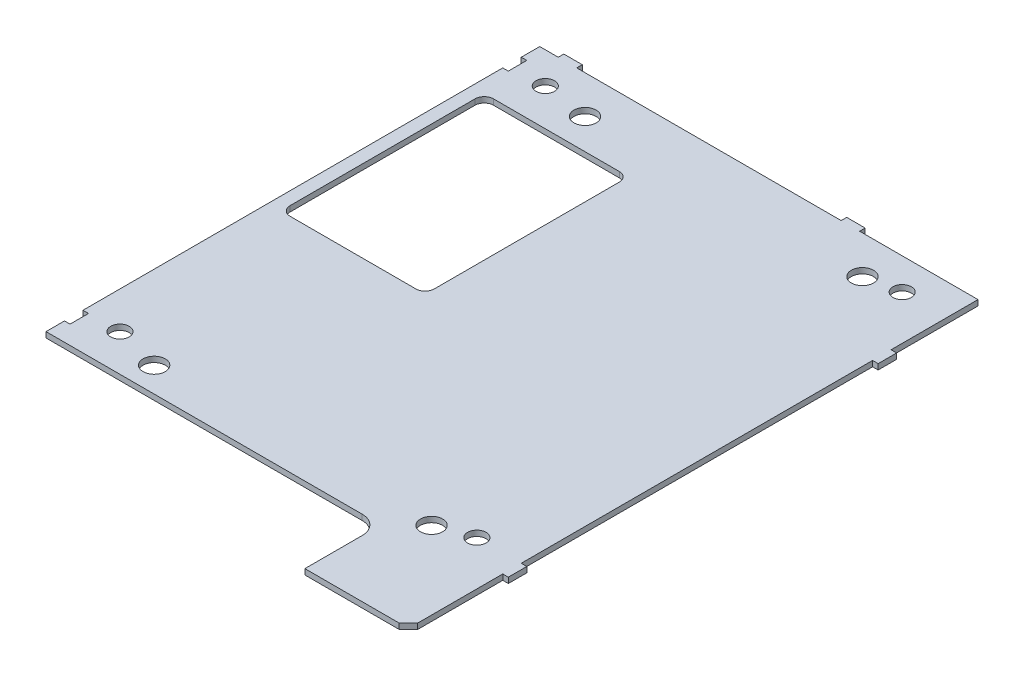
SolidWorks part; units mm, degrees
ref_plane "Спереди" through (0, 0, 0) normal (0, 0, 1) x (1, 0, 0)
ref_plane "Сверху" through (0, 0, 0) normal (0, 1, 0) x (1, 0, 0)
ref_plane "Справа" through (0, 0, 0) normal (1, 0, 0) x (0, 0, -1)
sketch "Эскиз1" plane through (0, 0, 0) normal (0, 1, 0) x (1, 0, 0)
  line L1 (0, 307) -> (530, 307)
  line L2 (0, 307) -> (0, 0)
  line L3 (0, 0) -> (530, 0)
  line L4 (530, 307) -> (530, 0)
  dimension "D2" = 307
  dimension "D4" = 530
extrude "Бобышка-Вытянуть1" add sketch "Эскиз1" along normal blind 3
sketch "Эскиз3" plane through (0, 3, 0) normal (0, 1, 0) x (1, 0, 0)
  line L0 (0, 307) -> (0, 0) construction
  line L1 (0, 270) -> (102, 270)
  line L2 (0, 270) -> (0, 70)
  line L3 (0, 70) -> (102, 70)
  line L4 (102, 270) -> (102, 70)
  line L6 (0, 0) -> (530, 0) construction
  dimension "D1" = 200
  dimension "D2" = 102
  dimension "D3" = 70
extrude "Вырез-Вытянуть2" cut sketch "Эскиз3" against normal through all
fillet "Скругление2" radius 5 2 edges at (102, 1.5, -70) (102, 1.5, -270)
sketch "Эскиз4" plane through (0, 3, 0) normal (0, 1, 0) x (1, 0, 0)
  line L0 (0, 0) -> (530, 0) construction
  line L1 (0, 307) -> (27.5, 307)
  line L2 (0, 307) -> (0, 0)
  line L3 (0, 0) -> (27.5, 0)
  line L4 (27.5, 307) -> (27.5, 0)
  dimension "D1" = 27.5
extrude "Вырез-Вытянуть3" cut sketch "Эскиз4" against normal through all
sketch "Эскиз7" plane through (0, 3, 0) normal (0, 1, 0) x (1, 0, 0)
  line L1 (530, 307) -> (700, 307)
  line L2 (530, 307) -> (530, 0)
  line L3 (530, 0) -> (700, 0)
  line L4 (700, 307) -> (700, 0)
  dimension "D1" = 170
extrude "Бобышка-Вытянуть2" add sketch "Эскиз7" against normal up to surface (3 mm away)
sketch "Эскиз8" plane through (0, 3, 0) normal (0, 1, 0) x (1, 0, 0)
  line L0 (700, 307) -> (27.5, 307) construction
  line L1 (530, 307) -> (700, 307)
  line L2 (530, 307) -> (530, 160)
  line L3 (530, 160) -> (700, 160)
  line L4 (700, 307) -> (700, 160)
  line L5 (700, 0) -> (700, 307) construction
  line L6 (27.5, 0) -> (700, 0) construction
  dimension "D1" = 170
  dimension "D2" = 160
extrude "Вырез-Вытянуть4" cut sketch "Эскиз8" against normal through all
sketch "Эскиз11" plane through (0, 0, 0) normal (0, -1, 0) x (1, 0, 0)
  line L0 (27.5, 0) -> (700, 0) construction
  line L1 (27.5, -70) -> (-20, -70)
  line L2 (27.5, -70) -> (27.5, 0)
  line L3 (530, -307) -> (27.5, -307) construction
  line L4 (-20, -70) -> (-20, 0)
  line L6 (27.5, -307) -> (-20, -307)
  line L7 (-20, -270) -> (-20, -307)
  line L8 (27.5, -270) -> (-20, -270)
  line L9 (27.5, -270) -> (27.5, -307)
  line L10 (27.5, 0) -> (-20, 0)
  line L11 (27.5, -270) -> (27.5, -307) construction
extrude "Бобышка-Вытянуть3" add sketch "Эскиз11" against normal up to surface (3 mm away)
hole_wizard "Диаметр отверстия Ø10.0 (10)1" positions "Эскиз12" profile "Эскиз14" hole size "Ø10.0" standard "ISO"
sketch "Эскиз12" plane through (0, 3, 0) normal (0, 1, 0) x (1, 0, 0)
  line L0 (700, 80) -> (135.4022, 80) construction
  line L1 (700, 0) -> (700, 160) construction
  point P0 (547.5, 152.5)
  point P2 (692.5, 152.5)
  point P4 (692.5, 7.5)
  point P6 (547.5, 7.5)
  dimension "D1" = 145
  dimension "D2" = 145
  dimension "D3" = 7.5
sketch "Эскиз14" plane through (547.5, 3, -152.5) normal (1, 0, 0) x (0, 0, 1)
  line L0 (0, 0) -> (0, 3)
  line L1 (0, 3) -> (5, 3)
  line L2 (5, 3) -> (5, 0)
  line L5 (5, 0) -> (0, 0)
  line L11 (0, -6.35) -> (0, 107.95) construction
  dimension "Диаметр сквозного отверстия" = 10
  dimension "Глубина сквозного отверстия" = 3
sketch "Эскиз16" plane through (0, 0, 0) normal (0, -1, 0) x (1, 0, 0)
  line L1 (-20, -70) -> (24, -70)
  line L2 (-20, -70) -> (-20, -270)
  line L3 (-20, -270) -> (24, -270)
  line L4 (24, -70) -> (24, -270)
  line L5 (97, -270) -> (-20, -270) construction
  dimension "D1" = 44
extrude "Бобышка-Вытянуть5" add sketch "Эскиз16" against normal up to surface (3 mm away)
fillet "Скругление4" radius 5 2 edges at (24, 1.5, -270) (24, 1.5, -70)
sketch "Эскиз18" plane through (0, 3, 0) normal (0, 1, 0) x (1, 0, 0)
  line L0 (700, 0) -> (700, 160) construction
  line L1 (700, 160) -> (707, 160)
  line L2 (700, 160) -> (700, 0)
  line L3 (700, 0) -> (707, 0)
  line L4 (707, 160) -> (707, 0)
  line L6 (-20, 0) -> (700, 0) construction
  dimension "D1" = 7
extrude "Бобышка-Вытянуть7" add sketch "Эскиз18" against normal up to surface (3 mm away)
sketch "Эскиз19" plane through (0, 3, 0) normal (0, 1, 0) x (1, 0, 0)
  line L1 (530, 160) -> (707, 160)
  line L2 (530, 160) -> (530, 0)
  line L3 (530, 0) -> (707, 0)
  line L4 (707, 160) -> (707, 0)
extrude "Вырез-Вытянуть5" cut sketch "Эскиз19" against normal through all
sketch "Эскиз21" plane through (0, 3, 0) normal (0, 1, 0) x (1, 0, 0)
  line L0 (-20, 0) -> (530, 0) construction
  line L1 (530, 307) -> (550, 307)
  line L2 (530, 307) -> (530, 0)
  line L3 (530, 0) -> (550, 0)
  line L4 (550, 307) -> (550, 0)
  dimension "D1" = 20
extrude "Бобышка-Вытянуть8" add sketch "Эскиз21" against normal up to surface (3 mm away)
sketch "Эскиз20" plane through (0, 3, 0) normal (0, 1, 0) x (1, 0, 0)
  line L0 (-20, 0) -> (550, 0) construction
  line L2 (550, 0) -> (550, 307) construction
  circle A0 centre (530.5, 65) radius 6
  circle A1 centre (400.5, 65) radius 6
  circle A2 centre (400.5, 255) radius 6
  circle A3 centre (530.5, 255) radius 6
  dimension "D1" = 12
  dimension "D2" = 65
  dimension "D4" = 190
  dimension "D5" = 19.5
  dimension "D3" = 130
extrude "Вырез-Вытянуть6" cut sketch "Эскиз20" against normal through all
sketch "Эскиз22" plane through (0, 3, 0) normal (0, 1, 0) x (1, 0, 0)
  line L0 (24, 265) -> (24, 75) construction
  line L1 (24, 160) -> (102, 160)
  line L2 (24, 160) -> (24, 70)
  line L3 (24, 70) -> (102, 70)
  line L4 (102, 160) -> (102, 70)
  line L5 (102, 75) -> (102, 265) construction
  line L6 (29, 70) -> (97, 70) construction
  line L7 (97, 270) -> (29, 270) construction
  dimension "D1" = 110
extrude "Бобышка-Вытянуть9" add sketch "Эскиз22" against normal up to surface (3 mm away)
fillet "Скругление5" radius 5 2 edges at (24, 1.5, -160) (102, 1.5, -160)
hole_wizard "Диаметр отверстия Ø12.0 (12)2" positions "Эскиз5" profile "Эскиз6" hole size "Ø12.0" standard "ISO"
sketch "Эскиз5" plane through (0, 0, 0) normal (0, -1, 0) x (-1, 0, 0)
  line L8 (20, 0) -> (20, 307) construction
  line L9 (20, 0) -> (-550, 0) construction
  point P0 (-62, 53.5)
  point P2 (-212, 53.5)
  point P4 (-212, 286.5)
  point P6 (-62, 286.5)
  dimension "D1" = 82
  dimension "D2" = 233
  dimension "D3" = 150
  dimension "D4" = 53.5
sketch "Эскиз6" plane through (62, 0, -53.5) normal (1, 0, 0) x (0, 0, -1)
  line L0 (0, 0) -> (0, 3)
  line L1 (0, 3) -> (6, 3)
  line L2 (6, 3) -> (6, 0)
  line L5 (6, 0) -> (0, 0)
  line L11 (0, -6.35) -> (0, 107.95) construction
  dimension "Диаметр сквозного отверстия" = 12
  dimension "Глубина сквозного отверстия" = 3
sketch "Эскиз23" plane through (0, 0, 0) normal (0, -1, 0) x (1, 0, 0)
  line L0 (-20, 0) -> (-20, -307) construction
  line L1 (-20, -50) -> (20, -50)
  line L2 (-20, -50) -> (-20, -60)
  line L3 (-20, -60) -> (20, -60)
  line L4 (20, -50) -> (20, -60)
  line L5 (20, -292) -> (12.7851, -292) construction
  line L6 (-20, -287) -> (20, -287)
  line L7 (-20, -287) -> (-20, -297)
  line L8 (-20, -297) -> (20, -297)
  line L9 (20, -287) -> (20, -297)
  line L10 (550, -307) -> (-20, -307) construction
  line L11 (20, -55) -> (8.4334, -55) construction
  line L12 (-20, 0) -> (550, 0) construction
  dimension "D1" = 10
  dimension "D2" = 40
  dimension "D3" = 15
  dimension "D4" = 55
  dimension "D5" = 237
extrude "Вырез-Вытянуть7" cut sketch "Эскиз23" against normal through all
sketch "Эскиз27" plane through (0, 0, 0) normal (0, -1, 0) x (1, 0, 0)
  line L0 (550, -307) -> (550, 0) construction
  line L1 (550, -284) -> (547, -284)
  line L2 (550, -284) -> (550, -294)
  line L3 (550, -294) -> (547, -294)
  line L4 (547, -284) -> (547, -294)
  line L5 (550, -289) -> (560.6555, -289) construction
  line L6 (550, -307) -> (-20, -307) construction
  line L7 (550, -10) -> (569.4363, -10) construction
  line L8 (550, -5) -> (547, -5)
  line L9 (550, -5) -> (550, -15)
  line L10 (550, -15) -> (547, -15)
  line L11 (547, -5) -> (547, -15)
  line L12 (-20, 0) -> (550, 0) construction
  dimension "D1" = 3
  dimension "D2" = 10
  dimension "D3" = 18
  dimension "D4" = 10
  dimension "D5" = 279
extrude "Вырез-Вытянуть10" cut sketch "Эскиз27" against normal through all
sketch "Эскиз29" plane through (0, 0, 0) normal (0, -1, 0) x (1, 0, 0)
  line L0 (-20, 0) -> (550, 0) construction
  line L1 (124, 0) -> (550, 0)
  line L2 (124, 0) -> (124, 8)
  line L3 (124, 8) -> (550, 8)
  line L4 (550, 0) -> (550, 8)
  dimension "D1" = 8
  dimension "D2" = 426
extrude "Бобышка-Вытянуть10" add sketch "Эскиз29" against normal up to surface (3 mm away)
sketch "Эскиз30" plane through (0, 0, 0) normal (0, -1, 0) x (1, 0, 0)
  line L0 (550, 8) -> (124, 8) construction
  line L1 (537, 8) -> (527, 8)
  line L2 (537, 8) -> (537, 5)
  line L3 (537, 5) -> (527, 5)
  line L4 (527, 8) -> (527, 5)
  line L5 (532, 8) -> (532, 17.6232) construction
  line L6 (550, -5) -> (550, 8) construction
  line L7 (337, 8) -> (337, -82.9964) construction
  line L8 (142, 8) -> (142, 17.6232) construction
  line L9 (137, 8) -> (137, 5)
  line L10 (137, 5) -> (147, 5)
  line L11 (147, 8) -> (147, 5)
  line L12 (137, 8) -> (147, 8)
  dimension "D1" = 18
  dimension "D2" = 3
  dimension "D3" = 10
extrude "Вырез-Вытянуть12" cut sketch "Эскиз30" against normal through all
sketch "Эскиз31" plane through (0, 3, 0) normal (0, 1, 0) x (1, 0, 0)
  line L0 (124, -8) -> (124, 0) construction
  line L1 (-20, 0) -> (124, 0)
  line L2 (-20, 0) -> (-20, 30)
  line L3 (-20, 30) -> (124, 30)
  line L4 (124, 0) -> (124, 30)
  line L5 (-20, 0) -> (124, 0) construction
  dimension "D1" = 30
extrude "Вырез-Вытянуть13" cut sketch "Эскиз31" against normal through all
sketch "Эскиз32" plane through (0, 3, 0) normal (0, 1, 0) x (1, 0, 0)
  line L1 (132.7371, 38.9005) -> (118.0838, 38.9005)
  line L2 (132.7371, 38.9005) -> (132.7371, 58.2879)
  line L3 (132.7371, 58.2879) -> (118.0838, 58.2879)
  line L4 (118.0838, 38.9005) -> (118.0838, 58.2879)
extrude "Бобышка-Вытянуть11" add sketch "Эскиз32" against normal up to surface (3 mm away)
sketch "Эскиз33" plane through (0, 3, 0) normal (0, 1, 0) x (1, 0, 0)
  line L0 (124, -8) -> (124, 30) construction
  line L1 (124, 15) -> (127, 15)
  line L2 (124, 15) -> (124, 5)
  line L3 (124, 5) -> (127, 5)
  line L4 (127, 15) -> (127, 5)
  line L5 (124, 10) -> (97.6734, 10) construction
  line L6 (137, -8) -> (124, -8) construction
  dimension "D1" = 3
  dimension "D2" = 10
  dimension "D3" = 18
extrude "Вырез-Вытянуть14" cut sketch "Эскиз33" against normal through all
sketch "Эскиз35" plane through (0, 0, 0) normal (0, -1, 0) x (1, 0, 0)
  line L0 (250.5, -4) -> (250.5, -16) construction
  line L1 (252, -4) -> (252, -16)
  line L2 (249, -4) -> (249, -16)
  line L3 (250.5, -10) -> (262.2456, -10) construction
  line L4 (-20, -60) -> (-20, -287) construction
  line L5 (527, 8) -> (147, 8) construction
  arc A0 (252, -4) -> (249, -4) centre (250.5, -4) ccw
  arc A1 (249, -16) -> (252, -16) centre (250.5, -16) ccw
  point P2 (250.5, -10)
  dimension "D1" = 12
  dimension "D2" = 3
  dimension "D3" = 270.5
  dimension "D4" = 18
extrude "Вырез-Вытянуть16" cut sketch "Эскиз35" against normal through all
sketch "Эскиз36" plane through (0, 0, 0) normal (0, -1, 0) x (1, 0, 0)
  line L1 (242.9245, -34.9142) -> (257.8646, -34.9142)
  line L2 (242.9245, -34.9142) -> (242.9245, -62.0362)
  line L3 (242.9245, -62.0362) -> (257.8646, -62.0362)
  line L4 (257.8646, -34.9142) -> (257.8646, -62.0362)
extrude "Бобышка-Вытянуть12" add sketch "Эскиз36" against normal up to surface (3 mm away)
sketch "Эскиз37" plane through (0, 0, 0) normal (0, -1, 0) x (1, 0, 0)
  line L0 (527, 8) -> (147, 8) construction
  line L1 (254, 8) -> (550, 8)
  line L2 (254, 8) -> (254, -307)
  line L3 (254, -307) -> (550, -307)
  line L4 (550, 8) -> (550, -307)
  line L5 (-20, -60) -> (-20, -287) construction
  dimension "D1" = 274
extrude "Вырез-Вытянуть17" cut sketch "Эскиз37" against normal through all
sketch "Эскиз38" plane through (0, 3, 0) normal (0, 1, 0) x (1, 0, 0)
  line L1 (124, 30) -> (254, 30)
  line L2 (124, 30) -> (124, -8)
  line L3 (124, -8) -> (254, -8)
  line L4 (254, 30) -> (254, -8)
extrude "Вырез-Вытянуть18" cut sketch "Эскиз38" against normal through all
sketch "Эскиз39" plane through (0, 3, 0) normal (0, 1, 0) x (1, 0, 0)
  line L0 (-20, 30) -> (-20, 50) construction
  line L1 (254, 30) -> (-20, 30)
  line L2 (254, 30) -> (254, 40)
  line L3 (254, 40) -> (-20, 40)
  line L4 (-20, 30) -> (-20, 40)
  dimension "D1" = 10
extrude "Вырез-Вытянуть19" cut sketch "Эскиз39" against normal through all
sketch "Эскиз40" plane through (0, 0, 0) normal (0, -1, 0) x (1, 0, 0)
  line L0 (254, -307) -> (-20, -307) construction
  line L1 (251, -307) -> (254, -307)
  line L2 (251, -307) -> (251, -247)
  line L3 (251, -247) -> (254, -247)
  line L4 (254, -307) -> (254, -247)
  line L5 (254, -40) -> (254, -307) construction
  dimension "D1" = 3
  dimension "D2" = 60
extrude "Вырез-Вытянуть20" [suppressed] cut sketch "Эскиз40" against normal through all
sketch "Эскиз41" plane through (0, 0, 0) normal (0, -1, 0) x (1, 0, 0)
  line L0 (254, -307) -> (-20, -307) construction
  line L1 (27, -307) -> (37, -307)
  line L2 (27, -307) -> (27, -310)
  line L3 (27, -310) -> (37, -310)
  line L4 (37, -307) -> (37, -310)
  line L5 (32, -310) -> (32, -329.9073) construction
  line L6 (-20, -297) -> (-20, -307) construction
  line L7 (185, -307) -> (185, -314.7834) construction
  line L8 (180, -307) -> (190, -307)
  line L9 (180, -307) -> (180, -310)
  line L10 (180, -310) -> (190, -310)
  line L11 (190, -307) -> (190, -310)
  dimension "D1" = 3
  dimension "D2" = 10
  dimension "D3" = 52
  dimension "D4" = 153
extrude "Бобышка-Вытянуть13" add sketch "Эскиз41" against normal up to surface (3 mm away)
sketch "Эскиз42" plane through (0, 0, 0) normal (0, -1, 0) x (1, 0, 0)
  line L0 (254, -40) -> (254, -307) construction
  line L1 (254, -50) -> (257, -50)
  line L2 (254, -50) -> (254, -60)
  line L3 (254, -60) -> (257, -60)
  line L4 (257, -50) -> (257, -60)
  line L5 (254, -55) -> (240.3545, -55) construction
  line L6 (254, -40) -> (-20, -40) construction
  line L7 (254, -255) -> (233.7, -255) construction
  line L8 (254, -250) -> (257, -250)
  line L9 (254, -250) -> (254, -260)
  line L10 (254, -260) -> (257, -260)
  line L11 (257, -250) -> (257, -260)
  dimension "D1" = 3
  dimension "D2" = 10
  dimension "D3" = 15
  dimension "D4" = 200
extrude "Бобышка-Вытянуть14" add sketch "Эскиз42" against normal up to surface (3 mm away)
sketch "Эскиз43" plane through (0, 3, 0) normal (0, 1, 0) x (1, 0, 0)
  line L1 (254, 40) -> (198, 40)
  line L2 (254, 40) -> (254, -1)
  line L3 (254, -1) -> (198, -1)
  line L4 (198, 40) -> (198, -1)
  dimension "D1" = 41
  dimension "D2" = 56
extrude "Бобышка-Вытянуть15" add sketch "Эскиз43" against normal up to surface (3 mm away)
chamfer "Фаска1" distance 5 angle 45 1 edges at (254, 1.5, 1)
fillet "Скругление6" radius 10 1 edges at (198, 1.5, -40)
sketch "Эскиз44" plane through (0, 0, 0) normal (0, -1, 0) x (1, 0, 0)
  line L0 (-20, -60) -> (-20, -287) construction
  line L1 (188, -40) -> (-20, -40) construction
  circle A0 centre (37, -60) radius 5
  dimension "D1" = 10
  dimension "D3" = 20
  dimension "D2" = 57
extrude "Вырез-Вытянуть21" cut sketch "Эскиз44" against normal through all
pattern_linear "Линейный массив1" count 2 spacing 193 along (1, 0, 0) count 2 spacing 230 along (0, 0, -1) of "Вырез-Вытянуть21"
sketch "Эскиз45" plane through (0, 3, 0) normal (0, 1, 0) x (1, 0, 0)
  line L0 (188, 40) -> (-20, 40) construction
  line L1 (-20, 307) -> (17, 307)
  line L2 (-20, 307) -> (-20, 40)
  line L3 (-20, 40) -> (17, 40)
  line L4 (17, 307) -> (17, 40)
  dimension "D1" = 37
extrude "Вырез-Вытянуть22" cut sketch "Эскиз45" against normal through all
